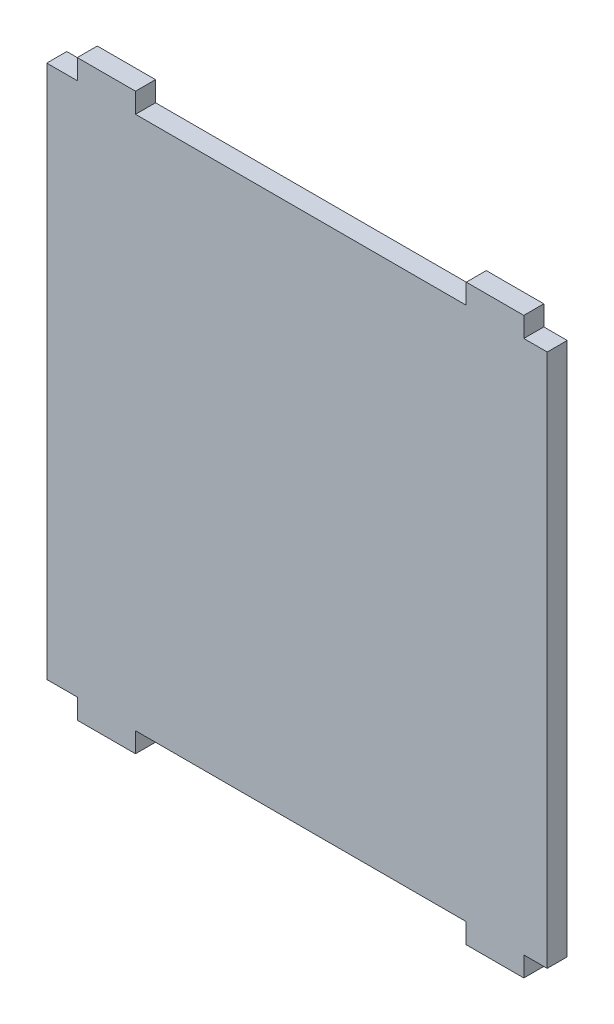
SolidWorks part; units mm, degrees
ref_plane "Plan de face" through (0, 0, 0) normal (0, 0, 1) x (1, 0, 0)
ref_plane "Plan de dessus" through (0, 0, 0) normal (0, 1, 0) x (1, 0, 0)
ref_plane "Plan de droite" through (0, 0, 0) normal (1, 0, 0) x (0, 0, -1)
sketch "Esquisse1" plane through (0, 0, 0) normal (0, 0, 1) x (1, 0, 0)
  line L0 (-88.6859, 80) -> (25.4417, 80) construction
  line L1 (-56.9044, 80) -> (18.0953, 80)
  line L2 (-56.9044, 80) -> (-56.9044, 0)
  line L3 (-56.9044, 0) -> (18.0953, 0)
  line L4 (18.0953, 80) -> (18.0953, 0)
  line L5 (74.1854, 0) -> (40.0596, 0) construction
extrude "Boss.-Extru.1" add sketch "Esquisse1" along normal blind 3
sketch "Esquisse2" plane through (0, 0, 3) normal (0, 0, 1) x (1, 0, 0)
  line L0 (-56.9044, 0) -> (18.0953, 0) construction
  line L1 (-52.3332, 0) -> (-43.6048, 0)
  line L2 (-52.3332, 0) -> (-52.3332, -3)
  line L3 (-52.3332, -3) -> (-43.6048, -3)
  line L4 (-43.6048, 0) -> (-43.6048, -3)
  line L5 (-84.1798, 0) -> (53.6472, 0) construction
  line L6 (-52.3332, -3) -> (-52.3332, 0) construction
  line L7 (5.9607, 0) -> (14.5843, 0)
  line L8 (5.9607, 0) -> (5.9607, -3)
  line L9 (5.9607, -3) -> (14.5843, -3)
  line L10 (14.5843, 0) -> (14.5843, -3)
  line L11 (-56.9044, 40) -> (18.0953, 40) construction
  line L12 (-56.9044, 80) -> (-56.9044, 0) construction
  line L13 (18.0953, 0) -> (18.0953, 80) construction
  line L14 (14.5843, 80) -> (14.5843, 83)
  line L15 (5.9607, 83) -> (14.5843, 83)
  line L16 (5.9607, 80) -> (5.9607, 83)
  line L17 (5.9607, 80) -> (14.5843, 80)
  line L18 (-43.6048, 80) -> (-43.6048, 83)
  line L19 (-52.3332, 83) -> (-43.6048, 83)
  line L20 (-52.3332, 80) -> (-52.3332, 83)
  line L21 (-52.3332, 80) -> (-43.6048, 80)
extrude "Boss.-Extru.2" add sketch "Esquisse2" against normal blind 3
